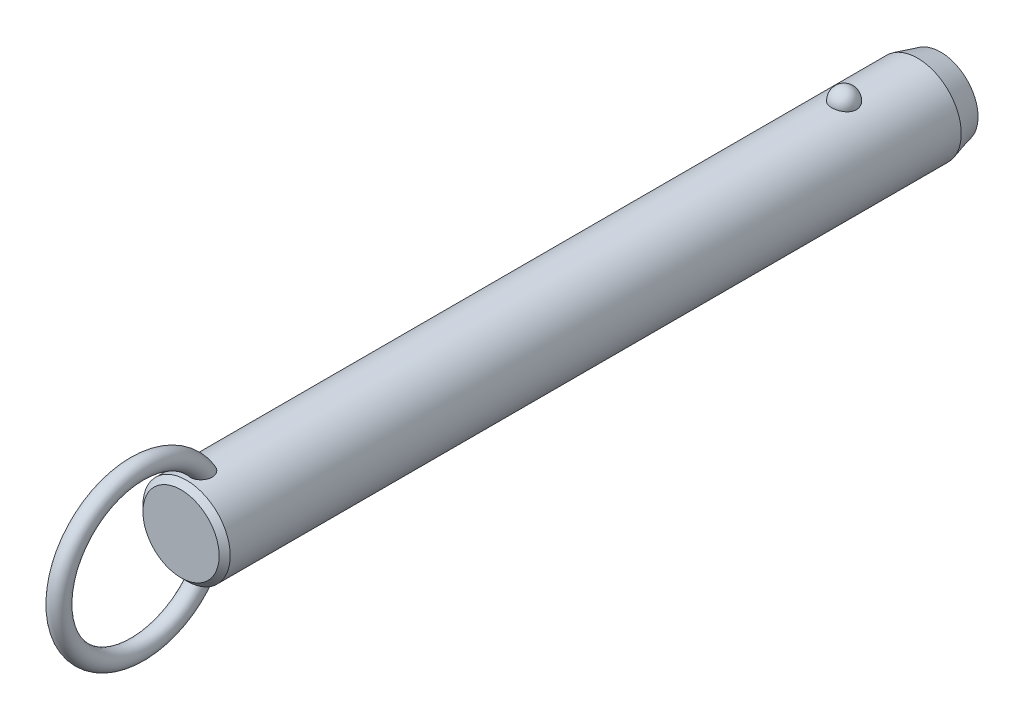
SolidWorks part; units mm, degrees
ref_plane "Front Plane" through (0, 0, 0) normal (0, 0, 1) x (1, 0, 0)
ref_plane "Top Plane" through (0, 0, 0) normal (0, 1, 0) x (1, 0, 0)
ref_plane "Right Plane" through (0, 0, 0) normal (1, 0, 0) x (0, 0, -1)
sketch "Sketch2" plane through (0, 0, 0) normal (0, 0, 1) x (1, 0, 0)
  circle A0 centre (0, 0) radius 9.5
  point P3 (0, 9.5)
  dimension "D1" = 19
extrude "Boss-Extrude1" add sketch "Sketch2" along normal blind 132.1
sketch "Sketch3" plane through (0, 0, 0) normal (0, 0, -1) x (-1, 0, 0)
  circle A0 centre (0, 0) radius 9.5
  dimension "D1" = 19
extrude "Boss-Extrude2" add sketch "Sketch3" along normal blind 23.7
chamfer "Chamfer1" distance 5 angle 15 1 edges at (-9.5, 0, -23.7)
sketch "Sketch12" plane through (0, 0, 0) normal (1, 0, 0) x (0, 0, -1)
  line L0 (-132.1, 9.5) -> (-132.1, -9.5) construction
  point P0 (-132.1, 0)
sketch "Sketch13" plane through (0, 0, 0) normal (1, 0, 0) x (0, 0, -1)
  circle A0 centre (-151.15, 0) radius 19.05
  point P2 (-132.1, 0)
  dimension "D1" = 38.1
sketch "Sketch14" plane through (0, 0, 0) normal (0, 1, 0) x (1, 0, 0)
  circle A0 centre (0, -134.1) radius 2
  point P2 (0, -132.1)
  dimension "D1" = 4
sweep "Sweep1" add profiles "Sketch14" path "Sketch13"
sketch "Sketch15" plane through (0, 0, 132.1) normal (0, 0, 1) x (1, 0, 0)
  circle A0 centre (0, 0) radius 9.5
  dimension "D1" = 19
extrude "Boss-Extrude3" add sketch "Sketch15" along normal blind 9.52
chamfer "Chamfer2" distance 1.2 angle 45 1 edges at (9.5, 0, 141.62)
sketch "Sketch18" plane through (0, 0, 0) normal (1, 0, 0) x (0, 0, -1)
  line L0 (18.7, 9.5) -> (-134.6378, 9.5) construction
  line L1 (2.7, 12.2) -> (2.7, 6.8)
  line L2 (-134.6378, -9.5) -> (18.7, -9.5) construction
  arc A0 (2.7, 12.2) -> (2.7, 6.8) centre (2.7, 9.5) ccw
  point P4 (0, 9.5)
  dimension "D1" = 21.7
revolve "Revolve1" add sketch "Sketch18" angle 360 about L1
